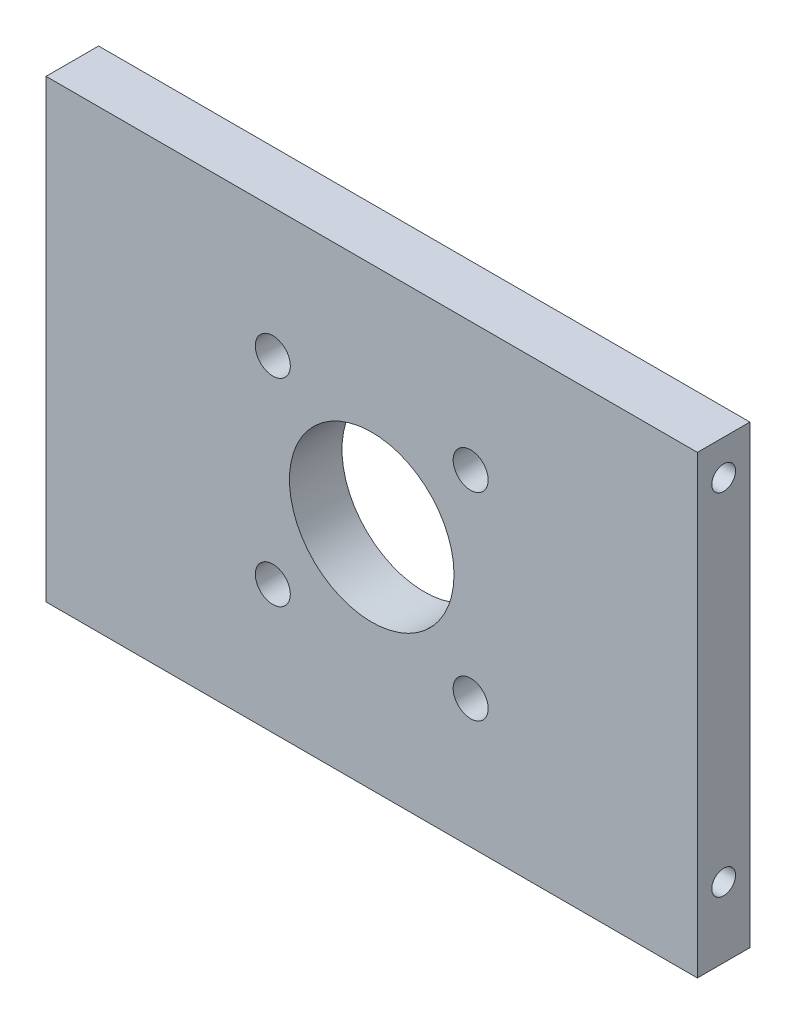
SolidWorks part; units mm, degrees
ref_plane "Face" through (0, 0, 0) normal (0, 0, 1) x (1, 0, 0)
ref_plane "Dessus" through (0, 0, 0) normal (0, 1, 0) x (1, 0, 0)
ref_plane "Droite" through (0, 0, 0) normal (1, 0, 0) x (0, 0, -1)
sketch "Esquisse1" plane through (0, 0, 0) normal (0, 0, 1) x (1, 0, 0)
  line L1 (-69.9731, 63.6935) -> (116.0269, 63.6935)
  line L2 (-69.9731, 63.6935) -> (-69.9731, -66.3065)
  line L3 (-69.9731, -66.3065) -> (116.0269, -66.3065)
  line L4 (116.0269, 63.6935) -> (116.0269, -66.3065)
  dimension "D1" = 186
  dimension "D2" = 130
extrude "Base-Extrusion" add sketch "Esquisse1" along normal blind 15
sketch "Esquisse2" plane through (0, 0, 15) normal (0, 0, 1) x (1, 0, 0)
  line L0 (-69.9731, -66.3065) -> (116.0269, -66.3065) construction
  line L1 (-69.9731, 63.6935) -> (-69.9731, -66.3065) construction
  line L2 (116.0269, 72.92) -> (116.0269, -71.3065) construction
  circle A0 centre (23.0269, -1.3065) radius 23.5
  dimension "D1" = 47
  dimension "D2" = 65
  dimension "D3" = 93
extrude "Enlèv. mat.-Extru.1" cut sketch "Esquisse2" against normal blind 15
hole_wizard "Trou taraudé M8x1.251" positions "Esquisse6" profile "Esquisse5" tap size "M8x1.25" standard "ISO"
sketch "Esquisse6" plane through (-69.9731, 0, 0) normal (-1, 0, 0) x (0, 0, 1)
  line L0 (15, 63.6935) -> (0, 63.6935) construction
  line L1 (0, -66.3065) -> (0, 63.6935) construction
  point P0 (7.5, 53.6935)
  point P1 (7.5, -46.3065)
  dimension "D1" = 100
  dimension "D2" = 10
  dimension "D3" = 7.5
  dimension "D4" = 7.5
sketch "Esquisse5" plane through (-69.9731, 53.6935, 7.5) normal (0, 1, 0) x (0, 0, 1)
  line L0 (0, 0) -> (0, 48.2929)
  line L1 (0, 48.2929) -> (3.4, 46.25)
  line L2 (3.4, 46.25) -> (3.4, 0)
  line L5 (3.4, 0) -> (0, 0)
  line L10 (0, 48.2929) -> (-3.4, 46.25) construction
  line L11 (0, -6.35) -> (0, 107.95) construction
  dimension "Diamètre du perçage" = 6.8
  dimension "Profondeur du perçage" = 46.25
  dimension "Angle de pointe" = 118
hole_wizard "Trou taraudé M8x1.252" positions "Esquisse8" profile "Esquisse7" tap size "M8x1.25" standard "ISO"
sketch "Esquisse8" plane through (116.0269, 0, 0) normal (1, 0, 0) x (0, 0, -1)
  line L0 (-15, 63.6935) -> (0, 63.6935) construction
  line L1 (0, -66.3065) -> (0, 63.6935) construction
  point P0 (-7.5, 53.6935)
  point P1 (-7.5, -46.3065)
  dimension "D1" = 10
  dimension "D2" = 100
  dimension "D3" = 7.5
  dimension "D4" = 7.5
sketch "Esquisse7" plane through (116.0269, 53.6935, 7.5) normal (0, 1, 0) x (0, 0, -1)
  line L0 (0, 0) -> (0, 48.2929)
  line L1 (0, 48.2929) -> (3.4, 46.25)
  line L2 (3.4, 46.25) -> (3.4, 0)
  line L5 (3.4, 0) -> (0, 0)
  line L10 (0, 48.2929) -> (-3.4, 46.25) construction
  line L11 (0, -6.35) -> (0, 107.95) construction
  dimension "Diamètre du perçage" = 6.8
  dimension "Profondeur du perçage" = 46.25
  dimension "Angle de pointe" = 118
sketch "Esquisse9" plane through (0, 0, 0) normal (0, 0, -1) x (-1, 0, 0)
  circle A0 centre (5.2231, 26.9435) radius 5
  circle A1 centre (5.2231, -29.5565) radius 5
  circle A2 centre (-51.2769, 26.9435) radius 5
  circle A3 centre (-51.2769, -29.5565) radius 5
  circle A4 centre (-23.0269, -1.3065) radius 23.5 construction
  dimension "D1" = 10
  dimension "D2" = 10
  dimension "D3" = 56.5
  dimension "D4" = 56.5
  dimension "D6" = 10
  dimension "D7" = 10
  dimension "D8" = 56.5
  dimension "D9" = 56.5
  dimension "D10" = 28.25
  dimension "D11" = 28.25
  dimension "D12" = 28.25
  dimension "D5" = 28.25
extrude "Enlèv. mat.-Extru.2" cut sketch "Esquisse9" against normal blind 20
ref_plane "Plan1" through (23.0269, 0, 0) normal (1, 0, 0) x (0, 0, -1)
